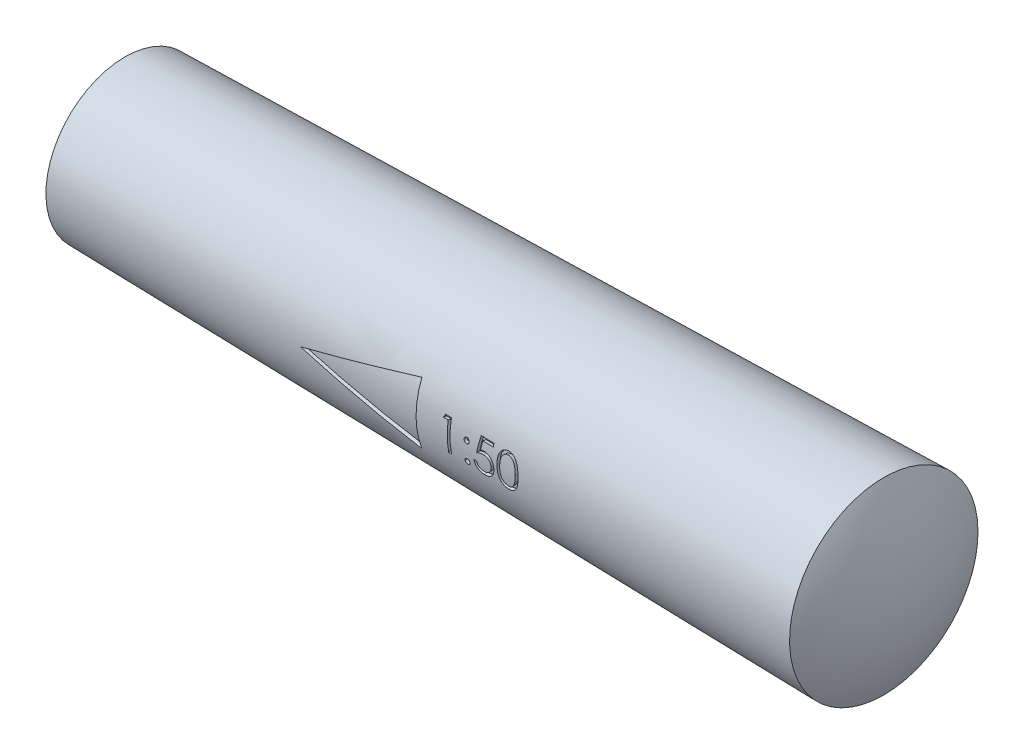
SolidWorks part; units mm, degrees
ref_plane "Front Plane" through (0, 0, 0) normal (0, 0, 1) x (1, 0, 0)
ref_plane "Top Plane" through (0, 0, 0) normal (0, 1, 0) x (1, 0, 0)
ref_plane "Right Plane" through (0, 0, 0) normal (1, 0, 0) x (0, 0, -1)
sketch "Sketch1" plane through (0, 0, 0) normal (1, 0, 0) x (0, 0, -1)
  circle A0 centre (0, 0) radius 2.5
  dimension "D1" = 5
extrude "Extrude1" add sketch "Sketch1" along normal mid plane 24
draft "Draft1" type of draft neutral plane draft angle 1.146 faces to draft 1 parameters "D1"=1.146
sketch "Sketch2" plane through (0, 0, 0) normal (0, 0, 1) x (1, 0, 0)
  line L0 (-12, 0) -> (-12, 2.5)
  line L1 (-12, 2.5) -> (-12, -2.5) construction
  line L2 (-12, 0) -> (-12.75, 0)
  line L3 (-12.75, 0) -> (-12.75, -2.74) construction
  line L4 (12, 0) -> (12, 2.98)
  line L5 (12, -2.98) -> (12, 2.98) construction
  line L6 (12, 0) -> (12.75, 0)
  line L7 (12.75, 0) -> (12.75, -2.74) construction
  line L8 (-12, -2.5) -> (12, -2.98) construction
  arc A0 (-12.75, 0) -> (-12, 2.5) centre (-8.2083, 0) cw
  arc A1 (12.75, 0) -> (12, 2.98) centre (6.4547, 0) ccw
  point P14 (0, -2.74)
revolve "Revolve1" add sketch "Sketch2" angle 360 about L2
sketch "Sketch5" plane through (0, 0, 0) normal (0, 0, 1) x (1, 0, 0)
  line L0 (0, 2.74) -> (0, -2.74) construction
  line L1 (12, 2.98) -> (-12, 2.5) construction
  line L2 (-12, -2.5) -> (12, -2.98) construction
ref_plane "Plane2" through (0, 0, 0) normal (-0.02, 0, 0.9998) x (0.9998, 0, 0.02)
sketch "Sketch6" plane through (0, 0, 0) normal (-0.02, 0, 0.9998) x (0.9998, 0, 0.02)
  line L0 (0, 0) -> (0, 1)
  line L1 (0, 2.74) -> (0, -2.74) construction
  line L2 (0, 1) -> (-3.7321, 0)
  line L3 (-3.7321, 0) -> (0, -1)
  line L4 (0, -1) -> (0, 0)
  line L5 (0, -0.5) -> (4, -0.5) construction
  text T0 "1:50" font "Century Gothic" height 1
  dimension "D1" = 2
  dimension "D2" = 30
  dimension "D3" = 4
wrap "Wrap2" sketch "Sketch6" wrap type deboss source sketch "Sketch6" thickness 0.1 parameters "D1"=0.1
equation "\"D2@Sketch2\" = \"D1@Sketch2\""
